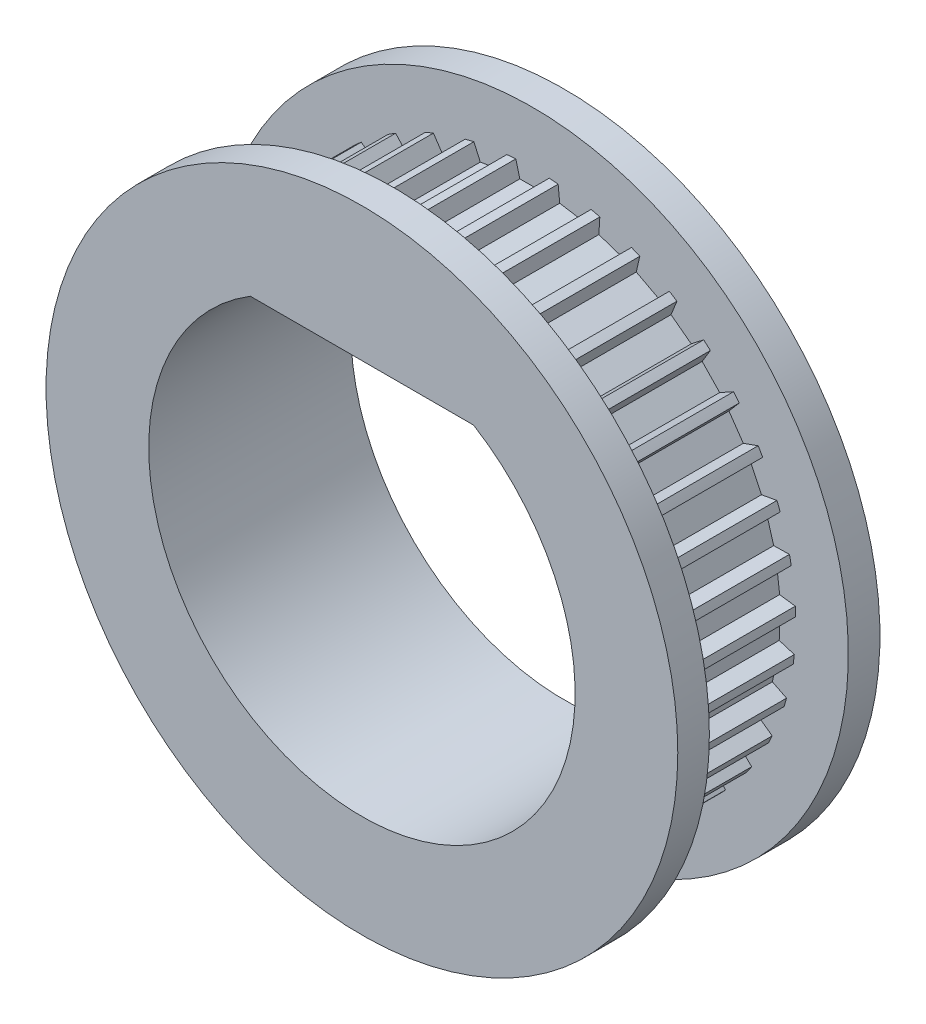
SolidWorks part; units mm, degrees
ref_plane "Front Plane" through (0, 0, 0) normal (0, 0, 1) x (1, 0, 0)
ref_plane "Top Plane" through (0, 0, 0) normal (0, 1, 0) x (1, 0, 0)
ref_plane "Right Plane" through (0, 0, 0) normal (1, 0, 0) x (0, 0, -1)
sketch "Sketch1" plane through (0, 0, 0) normal (0, 0, 1) x (1, 0, 0)
  circle A0 centre (0, 0) radius 12.5
  dimension "D1" = 25
extrude "Boss-Extrude1" add sketch "Sketch1" along normal mid plane 6.6
sketch "Sketch3" plane through (0, 0, 3.3) normal (0, 0, 1) x (1, 0, 0)
  circle A0 centre (0, 0) radius 15
  dimension "D1" = 30
sketch "Sketch2" plane through (0, 0, -3.3) normal (0, 0, -1) x (-1, 0, 0)
  circle A0 centre (0, 0) radius 15
  dimension "D1" = 30
sketch "Sketch4" plane through (0, 0, 3.3) normal (0, 0, 1) x (1, 0, 0)
  line L0 (-0.6, 11.75) -> (0.6, 11.75)
  line L1 (0.6, 11.75) -> (0.8, 12.5)
  line L2 (0.8, 12.5) -> (-0.8, 12.5)
  line L3 (-0.8, 12.5) -> (-0.6, 11.75)
  circle A0 centre (0, 0) radius 12.5 construction
  point P10 (0, 11.75)
  dimension "D1" = 1.2
  dimension "D2" = 1.6
  dimension "D3" = 0.75
extrude "Cut-Extrude1" cut sketch "Sketch4" against normal up to surface (6.6 mm away) and the other way through all
pattern_circular "CirPattern2" count 39 over 360 about axis through (0, 0, 0) along (0, 0, 1) of "Cut-Extrude1"
extrude "Boss-Extrude3" add sketch "Sketch2" along normal blind 1.5
extrude "Boss-Extrude4" add sketch "Sketch3" along normal blind 1.5 contours A0
sketch "Sketch6" plane through (0, 0, 4.8) normal (0, 0, 1) x (1, 0, 0)
  line L0 (-5.3033, 8.625) -> (5.3033, 8.625)
  circle A0 centre (0, 0) radius 10.125
  point P5 (0, 10.125)
  dimension "D1" = 20.25
  dimension "D2" = 1.5
extrude "Cut-Extrude3" cut sketch "Sketch6" against normal through all both and the other way through all contours L0 A0
